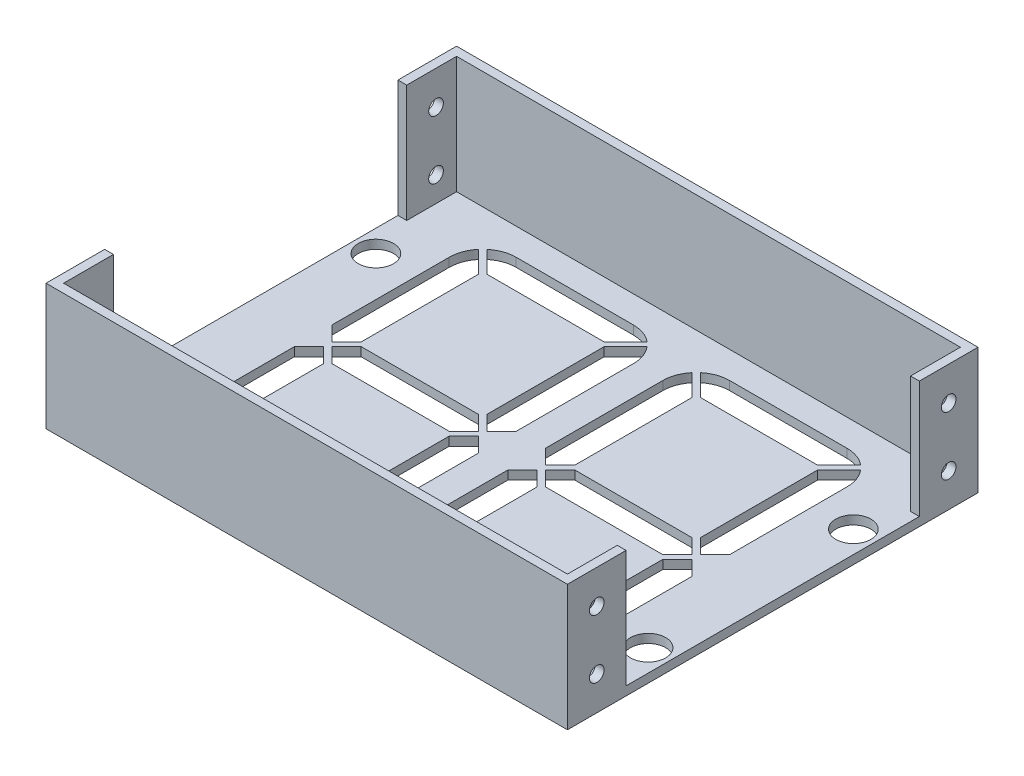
SolidWorks part; units mm, degrees
ref_plane "Alzado" through (0, 0, 0) normal (0, 0, 1) x (1, 0, 0)
ref_plane "Planta" through (0, 0, 0) normal (0, 1, 0) x (1, 0, 0)
ref_plane "Vista lateral" through (0, 0, 0) normal (1, 0, 0) x (0, 0, -1)
sketch "Croquis1" plane through (0, 0, 0) normal (0, 1, 0) x (1, 0, 0)
  line L0 (-11.41, 52.8269) -> (-9.0772, 55.1597)
  line L1 (-16.4135, -5.0035) -> (-56.4135, -5.0035)
  line L3 (-16.4135, 4.9965) -> (-56.4135, 4.9965)
  line L5 (-67.8269, 6.41) -> (-67.8269, -0.0035) construction
  line L6 (-9.9958, 51.4127) -> (-7.6631, 53.7454)
  line L7 (-56.4135, -5.0035) -> (-61.4135, -0.0035)
  line L8 (-61.4135, -0.0035) -> (-56.4135, 4.9965)
  line L9 (-11.4135, -0.0035) -> (-9.9992, 1.4108) construction
  line L10 (-16.4135, -5.0035) -> (-11.4135, -0.0035)
  line L11 (-11.4135, -0.0035) -> (-16.4135, 4.9965)
  line L12 (-9.9992, 1.4108) -> (-14.9985, 6.41)
  line L13 (-14.9985, 6.41) -> (-16.4135, 4.9965) construction
  line L14 (-14.9985, 6.41) -> (-14.9985, 46.41)
  line L15 (-14.9985, 46.41) -> (-9.9958, 51.4127)
  line L17 (-4.9965, 46.4135) -> (-4.9965, 6.4135)
  line L18 (-4.9965, 6.4135) -> (-9.9992, 1.4108)
  line L19 (14.9985, -6.4169) -> (16.4135, -5.0035) construction
  line L20 (-61.4135, -0.0035) -> (-62.8277, 1.4108) construction
  line L21 (-57.8284, 6.41) -> (-56.4135, 4.9965) construction
  line L22 (-62.8277, 1.4108) -> (-57.8284, 6.41)
  line L23 (-67.8269, 6.41) -> (-62.8277, 1.4108)
  line L24 (-67.8269, 46.41) -> (-67.8269, 6.41)
  line L26 (-57.8284, 46.41) -> (-62.8277, 51.4092)
  line L27 (-57.8284, 6.41) -> (-57.8284, 46.41)
  line L28 (11.4135, -0.0035) -> (9.9958, -1.4142) construction
  line L30 (-61.41, 52.8269) -> (-56.41, 47.8269)
  line L31 (-16.41, 47.8269) -> (-56.41, 47.8269)
  line L32 (-63.7434, 55.1603) -> (-61.41, 52.8269)
  line L33 (-62.8277, 51.4092) -> (-65.161, 53.7426)
  line L34 (57.8284, -6.4169) -> (56.4135, -5.0035) construction
  line L35 (-11.41, 52.8269) -> (-16.41, 47.8269)
  line L37 (-16.41, 57.8269) -> (-56.41, 57.8269)
  line L38 (-67.8269, -6.4169) -> (-62.8277, -1.4177)
  line L39 (-62.8277, -1.4177) -> (-57.8284, -6.4169)
  line L40 (-61.4135, -0.0035) -> (-62.8277, -1.4177) construction
  line L41 (-57.8284, -6.4169) -> (-56.4135, -5.0035) construction
  line L42 (-11.4135, -0.0035) -> (-9.9958, -1.4142) construction
  line L43 (-14.9985, -6.4169) -> (-16.4135, -5.0035) construction
  line L44 (-9.9958, -1.4142) -> (-14.9985, -6.4169)
  line L45 (-5, -6.4169) -> (-9.9958, -1.4142)
  line L46 (-57.8284, -6.4169) -> (-57.8284, -46.4169)
  line L47 (-67.8269, -46.4169) -> (-67.8269, -6.4169)
  line L48 (-5, -46.4238) -> (-5, -6.4169)
  line L49 (-14.9985, -6.4169) -> (-14.9985, -46.4169)
  line L50 (61.4135, -0.0035) -> (62.8277, -1.4177) construction
  line L51 (-63.7434, -55.1672) -> (-61.41, -52.8338)
  line L52 (-62.8277, -51.4162) -> (-65.161, -53.7495)
  line L53 (-16.41, -57.8338) -> (-56.41, -57.8338)
  line L55 (-11.4065, -52.8304) -> (-16.41, -47.8338)
  line L56 (-16.41, -47.8338) -> (-56.41, -47.8338)
  line L57 (-61.41, -52.8338) -> (-56.41, -47.8338)
  line L59 (-57.8284, -46.4169) -> (-62.8277, -51.4162)
  line L62 (-14.9985, -46.4169) -> (-9.9992, -51.4162)
  line L64 (57.8284, 6.41) -> (56.4135, 4.9965) construction
  line L65 (-7.6654, -53.7532) -> (-9.9992, -51.4162)
  line L66 (-11.4065, -52.8304) -> (-9.0758, -55.1644)
  line L67 (61.4135, -0.0035) -> (62.8277, 1.4108) construction
  line L68 (14.9985, 6.41) -> (16.4135, 4.9965) construction
  line L69 (11.4135, -0.0035) -> (9.9992, 1.4108) construction
  line L70 (11.4065, -52.8304) -> (9.0758, -55.1644)
  line L71 (7.6654, -53.7532) -> (9.9992, -51.4162)
  line L72 (14.9985, -46.4169) -> (9.9992, -51.4162)
  line L73 (57.8284, -46.4169) -> (62.8277, -51.4162)
  line L74 (61.41, -52.8338) -> (56.41, -47.8338)
  line L75 (16.41, -47.8338) -> (56.41, -47.8338)
  line L76 (11.4065, -52.8304) -> (16.41, -47.8338)
  line L77 (16.41, -57.8338) -> (56.41, -57.8338)
  line L78 (62.8277, -51.4162) -> (65.161, -53.7495)
  line L79 (63.7434, -55.1672) -> (61.41, -52.8338)
  line L80 (14.9985, -6.4169) -> (14.9985, -46.4169)
  line L81 (5, -46.4238) -> (5, -6.4169)
  line L82 (67.8269, -46.4169) -> (67.8269, -6.4169)
  line L83 (57.8284, -6.4169) -> (57.8284, -46.4169)
  line L84 (5, -6.4169) -> (9.9958, -1.4142)
  line L85 (9.9958, -1.4142) -> (14.9985, -6.4169)
  line L86 (62.8277, -1.4177) -> (57.8284, -6.4169)
  line L87 (67.8269, -6.4169) -> (62.8277, -1.4177)
  line L88 (16.41, 57.8269) -> (56.41, 57.8269)
  line L89 (11.41, 52.8269) -> (16.41, 47.8269)
  line L90 (62.8277, 51.4092) -> (65.161, 53.7426)
  line L91 (63.7434, 55.1603) -> (61.41, 52.8269)
  line L92 (16.41, 47.8269) -> (56.41, 47.8269)
  line L93 (61.41, 52.8269) -> (56.41, 47.8269)
  line L94 (57.8284, 6.41) -> (57.8284, 46.41)
  line L95 (57.8284, 46.41) -> (62.8277, 51.4092)
  line L96 (67.8269, 46.41) -> (67.8269, 6.41)
  line L97 (67.8269, 6.41) -> (62.8277, 1.4108)
  line L98 (62.8277, 1.4108) -> (57.8284, 6.41)
  line L99 (4.9965, 6.4135) -> (9.9992, 1.4108)
  line L100 (4.9965, 46.4135) -> (4.9965, 6.4135)
  line L101 (14.9985, 46.41) -> (9.9958, 51.4127)
  line L102 (14.9985, 6.41) -> (14.9985, 46.41)
  line L103 (9.9992, 1.4108) -> (14.9985, 6.41)
  line L104 (11.4135, -0.0035) -> (16.4135, 4.9965)
  line L105 (16.4135, -5.0035) -> (11.4135, -0.0035)
  line L106 (61.4135, -0.0035) -> (56.4135, 4.9965)
  line L107 (56.4135, -5.0035) -> (61.4135, -0.0035)
  line L108 (9.9958, 51.4127) -> (7.6631, 53.7454)
  line L109 (16.4135, 4.9965) -> (56.4135, 4.9965)
  line L110 (16.4135, -5.0035) -> (56.4135, -5.0035)
  line L111 (11.41, 52.8269) -> (9.0772, 55.1597)
  line L112 (-67.8269, -0.0035) -> (-73.9169, -0.0035) construction
  line L113 (-73.9169, -0.0035) -> (-88.9169, -0.0035) construction
  line L114 (67.8269, 6.41) -> (67.8269, -0.0035) construction
  line L115 (67.8269, -0.0035) -> (73.9169, -0.0035) construction
  line L116 (-36.41, -57.8338) -> (-36.41, -70.0138) construction
  line L117 (-88.9169, -0.0035) -> (-88.9169, -70.0138)
  line L118 (-88.9169, -70.0138) -> (82.8269, -70.0138)
  line L119 (-36.41, 57.8269) -> (-36.41, 70.0069) construction
  line L120 (-88.9169, -0.0035) -> (-88.9169, 70.0069)
  line L121 (-88.9169, 70.0069) -> (-36.41, 70.0069)
  line L122 (73.9169, -0.0035) -> (88.9169, -0.0035) construction
  line L123 (-36.41, 70.0069) -> (88.9169, 70.0069)
  line L124 (88.9169, 70.0069) -> (88.9169, -70.0138)
  line L125 (88.9169, -70.0138) -> (82.8269, -70.0138)
  line L126 (81.4169, -0.0035) -> (81.4169, -35.0035) construction
  line L127 (81.4169, -35.0035) -> (81.4169, 34.9965) construction
  line L128 (-81.4169, -0.0035) -> (-81.4169, 34.9965) construction
  line L129 (-81.4169, 34.9965) -> (-81.4169, -35.0035) construction
  arc A0 (-16.41, 57.8269) -> (-9.0772, 55.1597) centre (-16.41, 46.4135) cw
  arc A1 (-56.41, -57.8338) -> (-63.7434, -55.1672) centre (-56.41, -46.4169) cw
  arc A2 (-16.41, -57.8338) -> (-9.0758, -55.1644) centre (-16.41, -46.4238) ccw
  arc A3 (-56.41, 57.8269) -> (-63.7434, 55.1603) centre (-56.41, 46.41) ccw
  arc A4 (-65.161, -53.7495) -> (-67.8269, -46.4169) centre (-56.41, -46.4169) cw
  arc A5 (-7.6654, -53.7532) -> (-5, -46.4238) centre (-16.41, -46.4238) ccw
  arc A6 (-7.6631, 53.7454) -> (-4.9965, 46.4135) centre (-16.41, 46.4135) cw
  arc A7 (-65.161, 53.7426) -> (-67.8269, 46.41) centre (-56.41, 46.41) ccw
  arc A8 (65.161, 53.7426) -> (67.8269, 46.41) centre (56.41, 46.41) cw
  arc A9 (7.6631, 53.7454) -> (4.9965, 46.4135) centre (16.41, 46.4135) ccw
  arc A10 (7.6654, -53.7532) -> (5, -46.4238) centre (16.41, -46.4238) cw
  arc A11 (65.161, -53.7495) -> (67.8269, -46.4169) centre (56.41, -46.4169) ccw
  arc A12 (56.41, 57.8269) -> (63.7434, 55.1603) centre (56.41, 46.41) cw
  arc A13 (16.41, -57.8338) -> (9.0758, -55.1644) centre (16.41, -46.4238) cw
  arc A14 (56.41, -57.8338) -> (63.7434, -55.1672) centre (56.41, -46.4169) ccw
  arc A15 (16.41, 57.8269) -> (9.0772, 55.1597) centre (16.41, 46.4135) ccw
  circle A16 centre (-81.4169, -35.0035) radius 6
  circle A17 centre (-81.4169, 34.9965) radius 6
  circle A18 centre (81.4169, 34.9965) radius 6
  circle A19 centre (81.4169, -35.0035) radius 6
  point P0 (-36.41, 0)
  point P113 (36.41, 0)
extrude "Saliente-Extruir1" add sketch "Croquis1" along normal blind 3
sketch "Croquis2" plane through (0, 3, 0) normal (0, 1, 0) x (1, 0, 0)
  line L0 (-88.9169, 70.0069) -> (-85.9169, 70.0069) construction
  line L1 (88.9169, 70.0069) -> (-88.9169, 70.0069) construction
  line L2 (-85.9169, 70.0069) -> (-85.9169, 67.0069) construction
  line L3 (88.9169, -70.0138) -> (88.9169, -67.0138) construction
  line L4 (88.9169, -70.0138) -> (88.9169, 70.0069) construction
  line L5 (88.9169, -67.0138) -> (85.9169, -67.0138) construction
  line L6 (85.9169, 70.0069) -> (85.9169, 50.0069) construction
  line L7 (-85.9169, 67.0069) -> (85.9169, 67.0069)
  line L8 (-85.9169, 67.0069) -> (-85.9169, 50.0069)
  line L9 (-85.9169, -67.0138) -> (85.9169, -67.0138)
  line L10 (85.9169, 67.0069) -> (85.9169, 50.0069)
  line L11 (88.9169, -70.0138) -> (-88.9169, -70.0138)
  line L12 (88.9169, -70.0138) -> (88.9169, -50.0138)
  line L13 (88.9169, 70.0069) -> (-88.9169, 70.0069)
  line L14 (-88.9169, -70.0138) -> (-88.9169, -50.0138)
  line L15 (-85.9169, 70.0069) -> (-85.9169, 50.0069) construction
  line L16 (-85.9169, -70.0138) -> (-85.9169, -50.0138) construction
  line L17 (85.9169, -70.0138) -> (85.9169, -50.0138) construction
  line L18 (85.9169, -50.0138) -> (88.9169, -50.0138)
  line L19 (-85.9169, -50.0138) -> (-88.9169, -50.0138)
  line L20 (-85.9169, 50.0069) -> (-88.9169, 50.0069)
  line L21 (85.9169, 50.0069) -> (88.9169, 50.0069)
  line L22 (-88.9169, 50.0069) -> (-88.9169, 70.0069)
  line L23 (-85.9169, -50.0138) -> (-85.9169, -67.0138)
  line L24 (85.9169, -50.0138) -> (85.9169, -67.0138)
  line L25 (88.9169, 50.0069) -> (88.9169, 70.0069)
extrude "Saliente-Extruir2" add sketch "Croquis2" along normal blind 40
sketch "Croquis3" plane through (88.9169, 0, 0) normal (1, 0, 0) x (0, 0, -1)
  line L0 (-70.0138, 21.5) -> (-60.0138, 21.5) construction
  line L1 (-70.0138, 43) -> (-70.0138, 0) construction
  line L2 (70.0069, 21.5) -> (60.0069, 21.5) construction
  line L3 (70.0069, 43) -> (70.0069, 0) construction
  line L4 (60.0069, 21.5) -> (60.0069, 31.5) construction
  line L5 (60.0069, 31.5) -> (60.0069, 21.5) construction
  line L6 (60.0069, 21.5) -> (60.0069, 11.5) construction
  line L7 (-60.0138, 21.5) -> (-60.0138, 31.5) construction
  line L8 (-60.0138, 31.5) -> (-60.0138, 11.5) construction
  circle A0 centre (-60.0138, 31.5) radius 2.5
  circle A1 centre (-60.0138, 11.5) radius 2.5
  circle A2 centre (60.0069, 31.5) radius 2.5
  circle A3 centre (60.0069, 11.5) radius 2.5
extrude "Cortar-Extruir1" cut sketch "Croquis3" against normal blind 3
sketch "Croquis4" plane through (-88.9169, 0, 0) normal (-1, 0, 0) x (0, 0, 1)
  line L0 (-70.0069, 21.5) -> (-60.0069, 21.5) construction
  line L1 (-70.0069, 43) -> (-70.0069, 0) construction
  line L2 (70.0138, 21.5) -> (60.0138, 21.5) construction
  line L3 (70.0138, 43) -> (70.0138, 0) construction
  line L4 (60.0138, 21.5) -> (60.0138, 31.5) construction
  line L5 (60.0138, 31.5) -> (60.0138, 11.5) construction
  line L6 (-60.0069, 21.5) -> (-60.0069, 31.5) construction
  line L7 (-60.0069, 31.5) -> (-60.0069, 11.5) construction
  circle A0 centre (-60.0069, 11.5) radius 2.5
  circle A1 centre (-60.0069, 31.5) radius 2.5
  circle A2 centre (60.0138, 31.5) radius 2.5
  circle A3 centre (60.0138, 11.5) radius 2.5
extrude "Cortar-Extruir2" cut sketch "Croquis4" against normal blind 3
